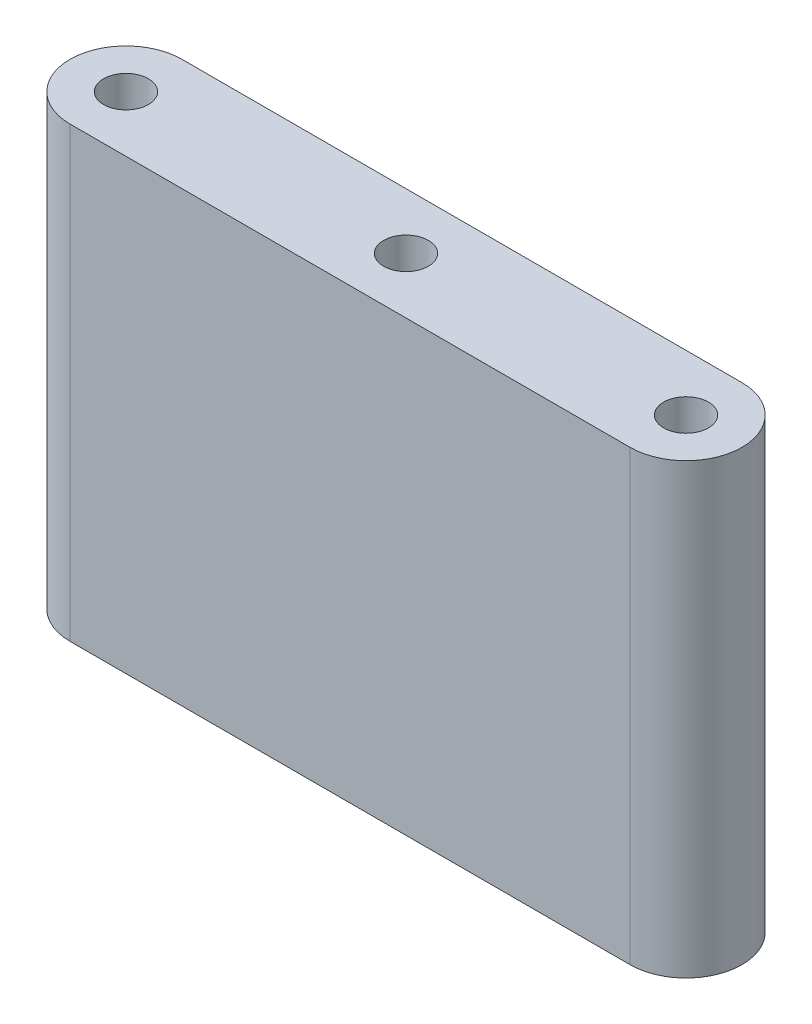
SolidWorks part; units mm, degrees
ref_plane "前视基准面" through (0, 0, 0) normal (0, 0, 1) x (1, 0, 0)
ref_plane "上视基准面" through (0, 0, 0) normal (0, 1, 0) x (1, 0, 0)
ref_plane "右视基准面" through (0, 0, 0) normal (1, 0, 0) x (0, 0, -1)
other "Configuration Table"
sketch "草图1" plane through (0, 0, 0) normal (0, 1, 0) x (1, 0, 0)
  line L0 (0, 0) -> (40, 0) construction
  line L1 (0, 4) -> (40, 4)
  line L2 (0, -4) -> (40, -4)
  arc A0 (0, 4) -> (0, -4) centre (0, 0) ccw
  arc A1 (40, -4) -> (40, 4) centre (40, 0) ccw
  circle A2 centre (0, 0) radius 1.6
  circle A3 centre (20, 0) radius 1.6
  circle A4 centre (40, 0) radius 1.6
  point P3 (20, 0)
  dimension "D2" = 3.2
  dimension "D4" = 4
  dimension "D5" = 4
  dimension "D3" = 20
  dimension "D1" = 3
extrude "凸台-拉伸1" add sketch "草图1" along normal mid plane 32
sketch "草图2" plane through (0, -16, 0) normal (0, -1, 0) x (1, 0, 0)
  line L1 (-1.5953, -25.2738) -> (2.6592, -25.2738)
  line L2 (2.6592, -25.2738) -> (12, -4)
  line L3 (40, -4) -> (0, -4) construction
  line L4 (12, -4) -> (0, -4)
  line L5 (0, -4) -> (-4, 0)
  line L6 (-1.5953, -25.2738) -> (-4, -16.3993)
  line L7 (-4, -16.3993) -> (-4, 0)
  line L8 (-1, -16) -> (0.7, -22.2738) construction
  arc A0 (0, 4) -> (0, -4) centre (0, 0) ccw construction
  circle A1 centre (0.7, -22.2738) radius 1.1
  circle A2 centre (-1, -16) radius 1.1
  dimension "D2" = 2.2
  dimension "D3" = 3
  dimension "D1" = 6.5
  dimension "D4" = 12
  dimension "D5" = 3
  dimension "D6" = 1.7
  dimension "D7" = 3
  dimension "D8" = 3
  dimension "D9" = 12
extrude "凸台-拉伸2" add sketch "草图2" against normal blind 8
fillet "圆角1" radius 3 4 edges at (12, -12, -4) (-4, -12, -16.3993) (2.6592, -12, -25.2738) (-1.5953, -12, -25.2738)
